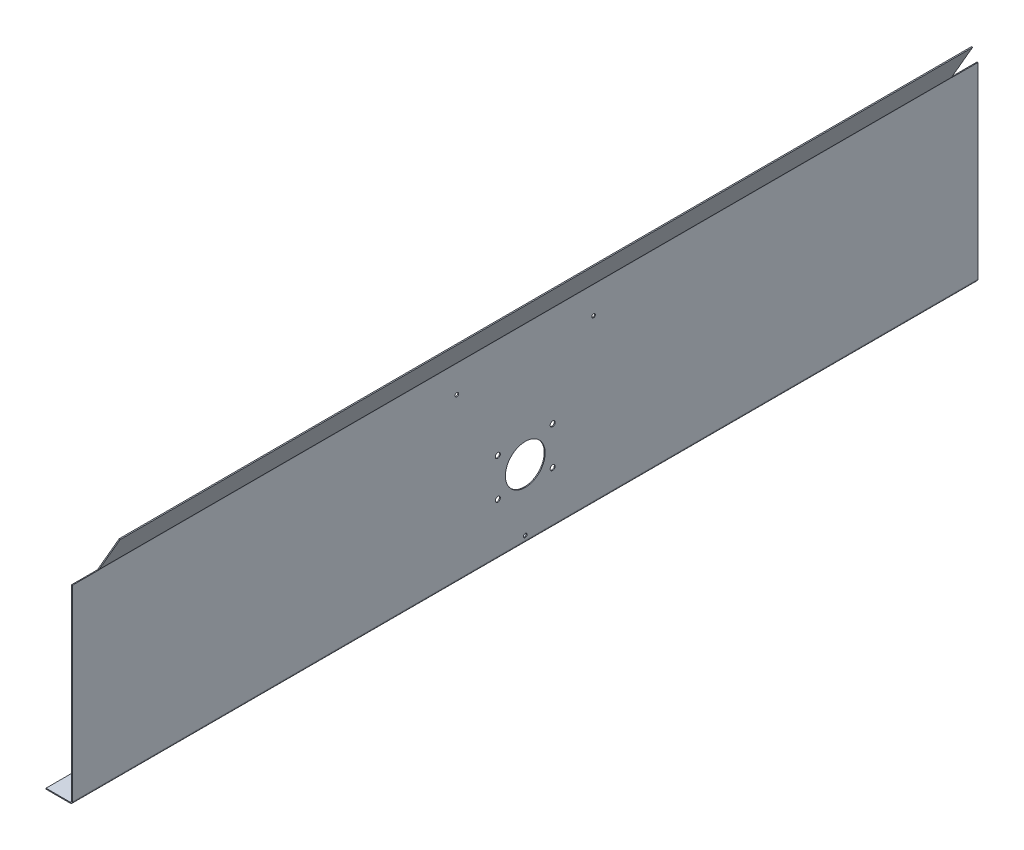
SolidWorks part; units mm, degrees
ref_plane "Face" through (0, 0, 0) normal (0, 0, 1) x (1, 0, 0)
ref_plane "Dessus" through (0, 0, 0) normal (0, 1, 0) x (1, 0, 0)
ref_plane "Droite" through (0, 0, 0) normal (1, 0, 0) x (0, 0, -1)
sketch "Esquisse1" plane through (0, 0, 0) normal (0, 0, 1) x (1, 0, 0)
  line L0 (0, 0) -> (53, 0)
  line L1 (58, 5) -> (58, 415.3301)
  line L2 (58.3349, 416.5801) -> (104, 495.6743)
  line L3 (0, 2) -> (53, 2)
  line L4 (56, 5) -> (56, 415.3301)
  line L5 (56.6029, 417.5801) -> (102.2679, 496.6743)
  line L6 (102.2679, 496.6743) -> (104, 495.6743)
  line L7 (0, 2) -> (0, 0)
  arc A0 (53, 0) -> (58, 5) centre (53, 5) ccw
  arc A1 (58, 415.3301) -> (58.3349, 416.5801) centre (60.5, 415.3301) cw
  arc A2 (53, 2) -> (56, 5) centre (53, 5) ccw
  arc A3 (56, 415.3301) -> (56.6029, 417.5801) centre (60.5, 415.3301) cw
  point P7 (58, 0)
  point P10 (58, 416)
  dimension "D5" = 5
  dimension "D6" = 2.5
  dimension "D1" = 58
  dimension "D2" = 92
  dimension "D3" = 416
  dimension "D4" = 150
  dimension "D7" = 2
extrude "Extrusion1" add sketch "Esquisse1" along normal mid plane 1980
sketch "Esquisse2" plane through (58, 0, 0) normal (1, 0, 0) x (0, 0, -1)
  line L0 (0, -13.423) -> (0, 396.131) construction
  line L1 (-81.6591, 149) -> (81.1124, 149) construction
  line L2 (-990, 0) -> (990, 0) construction
  circle A0 centre (0, 149) radius 43.5
  circle A1 centre (-60, 113) radius 5.5
  circle A2 centre (-60, 196) radius 5.5
  circle A3 centre (60, 196) radius 5.5
  circle A4 centre (60, 113) radius 5.5
  circle A5 centre (0, 14.5) radius 4
  circle A6 centre (-149.5, 356) radius 4
  circle A7 centre (149.5, 356) radius 4
  dimension "D1" = 87
  dimension "D2" = 120
  dimension "D4" = 83
  dimension "D5" = 149
  dimension "D6" = 8
  dimension "D8" = 8
  dimension "D3" = 11
  dimension "D11" = 11
  dimension "D12" = 47
  dimension "D13" = 120
  dimension "D7" = 14.5
  dimension "D9" = 299
  dimension "D10" = 356
extrude "Enlèv. mat.-Extru.1" cut sketch "Esquisse2" against normal through all
sketch "Esquisse3" plane through (56, 0, 0) normal (-1, 0, 0) x (0, 0, 1)
  line L0 (990, 496.6743) -> (990, 417.5801) construction
  line L1 (990, 415.3301) -> (932, 415.3301)
  line L2 (990, 415.3301) -> (990, 496.6743)
  line L3 (990, 496.6743) -> (932, 496.6743)
  line L4 (932, 415.3301) -> (932, 496.6743)
  line L5 (990, 496.6743) -> (-990, 496.6743) construction
  line L6 (990, 415.3301) -> (-990, 415.3301) construction
  line L7 (0, -20.907) -> (0, 517.9583) construction
  line L8 (-990, 415.3301) -> (-932, 415.3301)
  line L9 (-932, 415.3301) -> (-932, 496.6743)
  line L10 (-990, 496.6743) -> (-932, 496.6743)
  line L11 (-990, 415.3301) -> (-990, 496.6743)
  dimension "D1" = 58
extrude "Enlèv. mat.-Extru.2" cut sketch "Esquisse3" against normal through all
